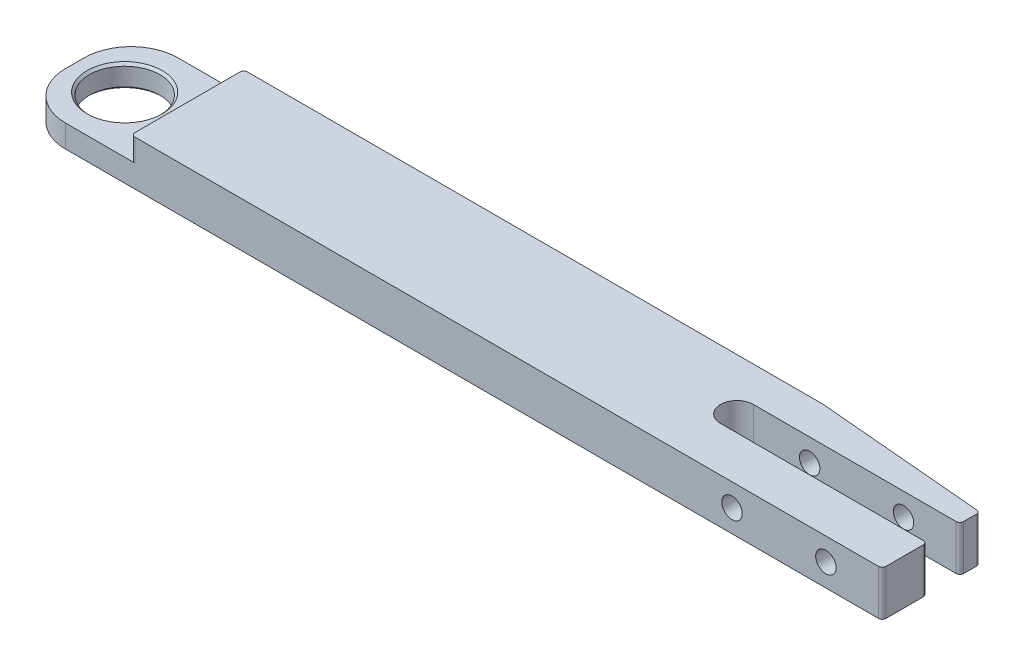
SolidWorks part; units mm, degrees
ref_plane "Front Plane" through (0, 0, 0) normal (0, 0, 1) x (1, 0, 0)
ref_plane "Top Plane" through (0, 0, 0) normal (0, 1, 0) x (1, 0, 0)
ref_plane "Right Plane" through (0, 0, 0) normal (1, 0, 0) x (0, 0, -1)
sketch "Sketch10" plane through (0, 0, 0) normal (0, 1, 0) x (1, 0, 0)
  line L0 (-73.025, 9.525) -> (-63.5, 9.525)
  line L5 (-53.975, 9.525) -> (73.025, 9.525)
  line L6 (-73.025, 9.525) -> (-73.025, -9.525)
  line L11 (-73.025, -9.525) -> (73.025, -9.525)
  line L12 (73.025, 9.525) -> (73.025, -9.525)
  line L13 (0, -9.525) -> (0, 9.525) construction
  line L14 (-73.025, 0) -> (73.025, 0) construction
  line L15 (-63.5, 9.525) -> (-53.975, 9.525)
  line L16 (-73.025, 9.525) -> (-73.025, 11.684) construction
  line L17 (-73.025, 11.684) -> (-53.975, 11.684) construction
  line L18 (-53.975, 9.525) -> (-53.975, 11.684) construction
  line L19 (-63.5, 11.684) -> (-63.5, 9.525) construction
  line L20 (-73.025, 10.6045) -> (-53.975, 10.6045) construction
  line L21 (-73.025, 9.525) -> (-63.5, 9.525) construction
  line L22 (-63.5, 9.525) -> (-53.975, 9.525) construction
  point P0 (0, 0)
  point P107 (-63.5, 10.6045)
  dimension "D1" = 19.05
  dimension "D2" = 146.05
  dimension "D3" = 19.05
  dimension "D4" = 2.159
extrude "Boss-Extrude2" add sketch "Sketch10" along normal mid plane 7.62 separate body
sketch "Sketch11" plane through (0, 3.81, 0) normal (0, 1, 0) x (1, 0, 0)
  line L0 (-73.025, -9.525) -> (73.025, -9.525) construction
  line L5 (-73.025, 9.525) -> (-53.975, 9.525)
  line L6 (-73.025, 9.525) -> (-73.025, -9.525)
  line L7 (-73.025, -9.525) -> (-53.975, -9.525)
  line L10 (-53.975, 9.525) -> (-53.975, -9.525)
  line L11 (-63.5, -9.525) -> (-63.5, 9.525) construction
  line L12 (-73.025, 0) -> (-53.975, 0) construction
  point P96 (-63.5, 0)
  dimension "D1" = 19.05
extrude "Cut-Extrude4" cut sketch "Sketch11" against normal offset from surface (3.81 mm away) 3.81
hole_wizard "15/32 (0.46875) Diameter Hole1" positions "Sketch12" profile "Sketch13" hole size "15/32" standard "ANSI Inch"
sketch "Sketch12" plane through (0, 0, 0) normal (0, 1, 0) x (1, 0, 0)
  line L23 (-73.025, -9.525) -> (-73.025, 9.525) construction
  line L24 (-73.025, -9.525) -> (73.025, -9.525) construction
  point P240 (-64.564, -0.016)
  dimension "D1" = 9.509
  dimension "D2" = 8.461
sketch "Sketch13" plane through (-64.564, 0, 0.016) normal (1, 0, 0) x (0, 0, 1)
  line L0 (0, 0) -> (0, 3.81)
  line L1 (0, 3.81) -> (6.35, 3.81)
  line L2 (5.9531, 3.4131) -> (5.9531, 0.3969)
  line L3 (5.9531, 0.3969) -> (6.35, 0)
  line L5 (6.35, 0) -> (0, 0)
  line L6 (-5.9531, 0.3969) -> (-6.35, 0) construction
  line L7 (6.35, 3.81) -> (5.9531, 3.4131)
  line L8 (-6.35, 3.81) -> (-5.9531, 3.4131) construction
  line L11 (0, -6.35) -> (0, 107.95) construction
  dimension "Thru Hole Dia." = 11.9062
  dimension "Thru Hole Depth" = 3.81
  dimension "Near C'Sink Dia." = 12.7
  dimension "Near C'Sink Angle" = 90
  dimension "Far C'Sink Dia." = 12.7
  dimension "Far C'Sink Angle" = 90
sketch "Sketch14" plane through (0, 3.81, 0) normal (0, 1, 0) x (1, 0, 0)
  line L0 (107.95, 0.8255) -> (38.1, 0.8255) construction
  line L1 (73.025, -9.525) -> (73.025, 9.525) construction
  line L2 (107.95, -1.9526) -> (38.1, -1.9526)
  line L3 (107.95, 3.6036) -> (38.1, 3.6036)
  line L4 (73.025, -9.525) -> (73.025, 9.525) construction
  line L5 (73.025, 9.525) -> (-53.975, 9.525) construction
  arc A0 (107.95, -1.9526) -> (107.95, 3.6036) centre (107.95, 0.8255) ccw
  arc A1 (38.1, 3.6036) -> (38.1, -1.9526) centre (38.1, 0.8255) ccw
  point P5 (73.025, 0.8255)
  point P10 (0, 0)
  point P11 (76.5415, 2.8883)
  point P14 (73.025, 0)
  dimension "D1" = 5.5562
  dimension "D2" = 34.925
  dimension "D3" = 8.6995
extrude "Cut-Extrude5" cut sketch "Sketch14" against normal up to next
hole_wizard "CBORE for #4 Binding Head Machine Screw1" positions "Sketch15" profile "Sketch16" counterbore size "#4" standard "ANSI Inch"
sketch "Sketch15" plane through (0, 0, -9.525) normal (0, 0, 1) x (1, 0, 0)
  line L0 (47.625, 0) -> (63.5, 0)
  line L2 (73.025, 3.81) -> (73.025, -3.81) construction
  point P0 (63.5, 0)
  point P2 (47.625, 0)
  dimension "D1" = 15.875
  dimension "D2" = 9.525
sketch "Sketch16" plane through (63.5, 0, -9.525) normal (1, 0, 0) x (0, 1, 0)
  line L0 (0, 0) -> (0, 19.05)
  line L1 (0, 19.05) -> (1.7272, 19.05)
  line L3 (1.7272, 19.05) -> (1.7272, 3.175)
  line L4 (1.7272, 3.175) -> (3.3731, 3.175)
  line L5 (3.3731, 3.175) -> (3.3731, 0)
  line L7 (3.3731, 0) -> (0, 0)
  line L11 (0, -6.35) -> (0, 107.95) construction
  dimension "Thru Hole Dia." = 3.4544
  dimension "Thru Hole Depth" = 19.05
  dimension "C'Bore Dia." = 6.7462
  dimension "C'Bore Depth" = 3.175
chamfer "Chamfer5" distance 2.54 angle 85 1 edges at (73.025, 0, -9.525)
fillet "Fillet9" radius 0.635 6 edges at (73.025, 0, -3.6036) (73.025, 0, 1.9526) (73.025, 0, 9.525) (-53.975, 1.905, 9.525) (-53.975, 1.905, -9.525) (73.025, 0, -6.985)
fillet "Fillet11" radius 7.9375 2 edges at (-73.025, -1.905, 9.525) (-73.025, -1.905, -9.525)
